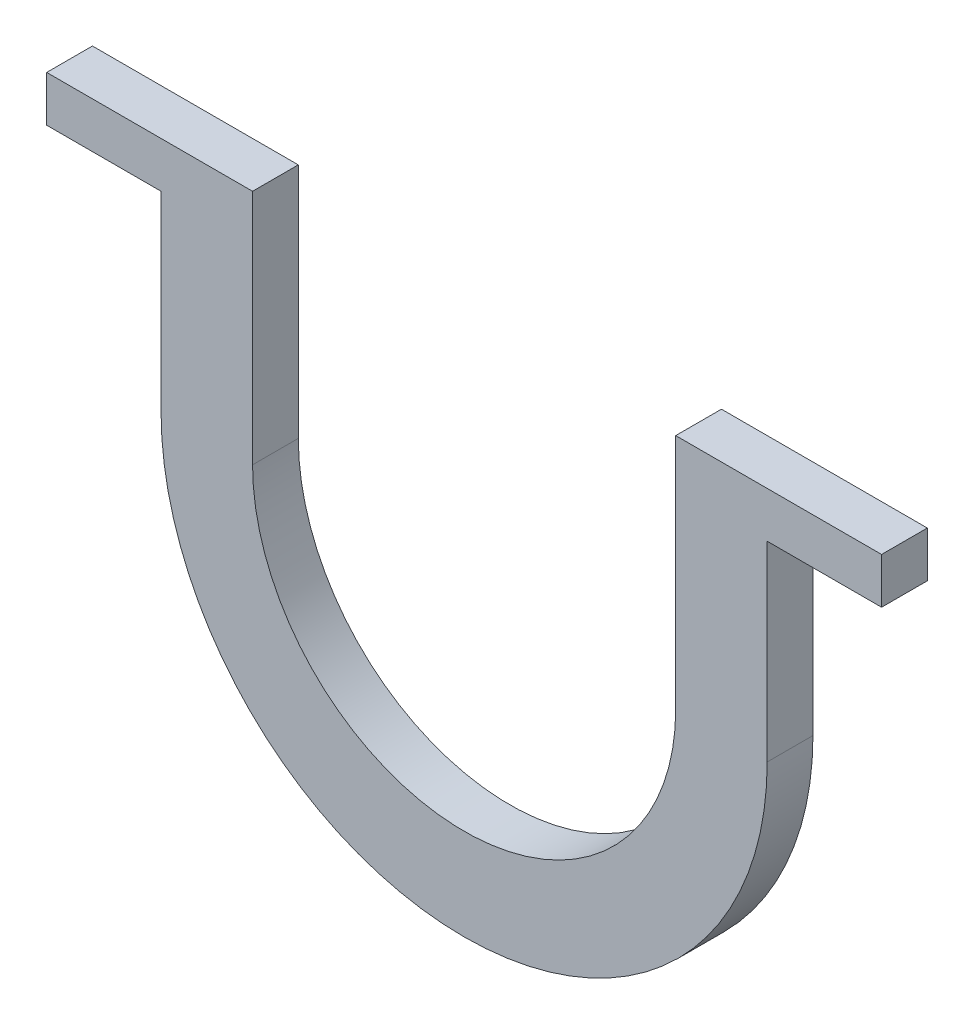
SolidWorks part; units mm, degrees
ref_plane "Front Plane" through (0, 0, 0) normal (0, 0, 1) x (1, 0, 0)
ref_plane "Top Plane" through (0, 0, 0) normal (0, 1, 0) x (1, 0, 0)
ref_plane "Right Plane" through (0, 0, 0) normal (1, 0, 0) x (0, 0, -1)
sketch "Sketch1" plane through (0, 0, 0) normal (0, 0, 1) x (1, 0, 0)
  line L1 (-20.4893, 1.5933) -> (-20.4893, 22.3069)
  line L2 (16.5107, 1.5933) -> (16.5107, 22.3069)
  line L3 (-20.4893, 1.5933) -> (-28.4893, 1.5933) construction
  line L5 (-28.4893, 1.5933) -> (-28.4893, 22.3069)
  line L6 (-28.4893, 22.3069) -> (-20.4893, 22.3069)
  line L7 (24.5107, 1.5933) -> (24.5107, 22.3069)
  line L8 (24.5107, 22.3069) -> (16.5107, 22.3069)
  arc A0 (-20.4893, 1.5933) -> (16.5107, 1.5933) centre (-1.9893, 1.5933) ccw
  arc A1 (-28.4893, 1.5933) -> (24.5107, 1.5933) centre (-1.9893, 1.5933) ccw
  dimension "D1" = 37
  dimension "D2" = 8
extrude "Boss-Extrude1" add sketch "Sketch1" along normal blind 4
sketch "Sketch3" plane through (24.5107, 0, 0) normal (1, 0, 0) x (0, 0, -1)
  line L0 (0, 1.5933) -> (0, 22.3069) construction
  line L1 (0, 22.3069) -> (-4, 22.3069)
  line L2 (0, 22.3069) -> (0, 18.3069)
  line L3 (0, 18.3069) -> (-4, 18.3069)
  line L4 (-4, 22.3069) -> (-4, 18.3069)
  line L5 (-4, 22.3069) -> (0, 22.3069) construction
  line L6 (-4, 1.5933) -> (-4, 22.3069) construction
  dimension "D1" = 4
extrude "Boss-Extrude3" add sketch "Sketch3" along normal blind 10
sketch "Sketch4" plane through (-28.4893, 0, 0) normal (-1, 0, 0) x (0, 0, 1)
  line L0 (4, 22.3069) -> (4, 1.5933) construction
  line L1 (0, 22.3069) -> (4, 22.3069)
  line L2 (0, 22.3069) -> (0, 18.3069)
  line L3 (0, 18.3069) -> (4, 18.3069)
  line L4 (4, 22.3069) -> (4, 18.3069)
extrude "Boss-Extrude4" add sketch "Sketch4" along normal blind 10
equation "\"thickness of material\"= 4mm"
equation "\"Length\"= 120mm"
equation "\"width\"= 60mm"
equation "\"length of strip\"= 60mm"
equation "\"width of strip\"= 10mm"
equation "\"D1@Boss-Extrude1\"=\"thickness of material\""
equation "\"D1@Boss-Extrude2\"=\"thickness of material\""
equation "\"D1@Sketch4\"=\"thickness of material\""
